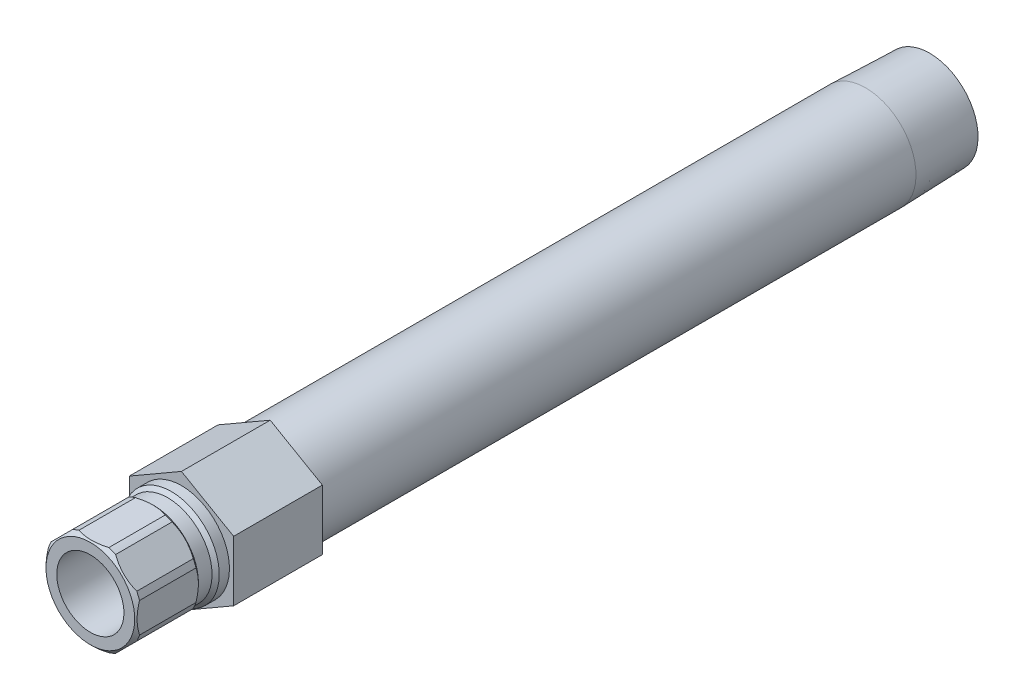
SolidWorks part; units mm, degrees
ref_plane "Front Plane" through (0, 0, 0) normal (0, 0, 1) x (1, 0, 0)
ref_plane "Top Plane" through (0, 0, 0) normal (0, 1, 0) x (1, 0, 0)
ref_plane "Right Plane" through (0, 0, 0) normal (1, 0, 0) x (0, 0, -1)
sketch "Sketch1" plane through (0, 0, 0) normal (1, 0, 0) x (0, 0, -1)
  line L0 (0, 0) -> (-22.479, 0) construction
  line L1 (-19.304, 7.112) -> (-19.304, 9.398)
  line L2 (-5.8166, 9.398) -> (-5.8166, 0) construction
  line L3 (-18.542, 10.16) -> (-6.5786, 10.16)
  line L4 (0, 10.668) -> (0, 0) construction
  line L5 (-5.8166, 9.398) -> (-2.921, 9.398)
  line L6 (-2.159, 10.16) -> (0, 10.16)
  line L7 (0, 10.16) -> (0, 10.668)
  line L8 (-5.8166, 9.398) -> (-6.5786, 10.16)
  line L9 (-2.921, 9.398) -> (-2.159, 10.16)
  line L10 (-19.304, 9.398) -> (-18.542, 10.16)
  line L11 (-19.304, 7.112) -> (-1.524, 7.112)
  line L12 (0, 10.668) -> (144.9324, 10.668)
  line L13 (144.9324, 10.668) -> (158.496, 10.2441)
  line L14 (158.496, 10.2441) -> (158.496, 7.8994)
  line L15 (0, 10.16) -> (18.796, 10.16) construction
  line L16 (18.796, 10.16) -> (18.796, 0) construction
  line L17 (18.796, 0) -> (0, 0) construction
  line L18 (-1.524, 7.112) -> (-1.1053, 7.8994)
  line L19 (-1.1053, 7.8994) -> (158.496, 7.8994)
  dimension "D1" = 19.304
  dimension "D2" = 2.8956
  dimension "D3" = 0.762
  dimension "D4" = 45
  dimension "D5" = 13.4874
  dimension "D6" = 45
  dimension "D7" = 1.79
  dimension "D8" = 13.5636
  dimension "D9" = 177.8
  dimension "D10" = 3.175
  dimension "D11" = 38.1
  dimension "D12" = 14.224
  dimension "D13" = 21.336
  dimension "D14" = 20.32
  dimension "D15" = 15.7988
  dimension "D16" = 118
  dimension "D17" = 17.78
revolve "Revolve1" add sketch "Sketch1" angle 360 about L0
sketch "Sketch2" plane through (0, 0, 0) normal (0, 0, 1) x (1, 0, 0)
  line L1 (-11.049, 6.3791) -> (-11.049, -6.3791)
  line L2 (-11.049, -6.3791) -> (0, -12.7583)
  line L3 (0, -12.7583) -> (11.049, -6.3791)
  line L4 (11.049, -6.3791) -> (11.049, 6.3791)
  line L5 (11.049, 6.3791) -> (0, 12.7583)
  line L6 (0, 12.7583) -> (-11.049, 6.3791)
  circle A0 centre (0, 0) radius 11.049 construction
  circle A1 centre (0, 0) radius 7.112 construction
  circle A2 centre (0, 0) radius 7.112
  dimension "D1" = 22.098
extrude "Boss-Extrude1" add sketch "Sketch2" against normal up to vertex (18.796 mm away) from vertex at 0
sketch "Sketch3" plane through (0, 0, 0) normal (0, 0, 1) x (1, 0, 0)
  line L1 (9.652, -3.998) -> (9.652, 3.998)
  line L2 (9.652, 3.998) -> (3.998, 9.652)
  line L3 (3.998, 9.652) -> (-3.998, 9.652)
  line L4 (-3.998, 9.652) -> (-9.652, 3.998)
  line L5 (-9.652, 3.998) -> (-9.652, -3.998)
  line L6 (-9.652, -3.998) -> (-3.998, -9.652)
  line L7 (-3.998, -9.652) -> (3.998, -9.652)
  line L8 (3.998, -9.652) -> (9.652, -3.998)
  circle A0 centre (0, 0) radius 9.652 construction
  dimension "D1" = 19.304
extrude "Cut-Extrude1" cut sketch "Sketch3" along normal through all from vertex at 5.8166 flip side to cut
